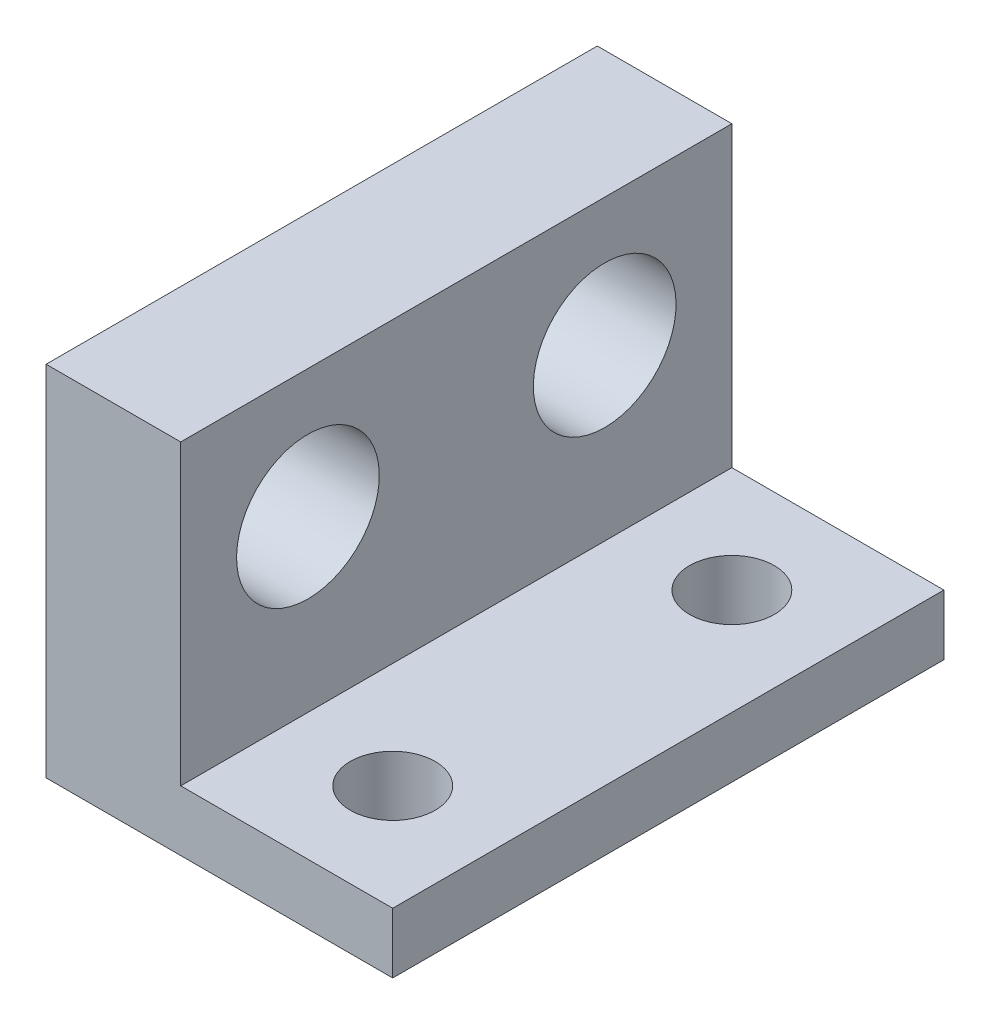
SolidWorks part; units mm, degrees
ref_plane "Front Plane" through (0, 0, 0) normal (0, 0, 1) x (1, 0, 0)
ref_plane "Top Plane" through (0, 0, 0) normal (0, 1, 0) x (1, 0, 0)
ref_plane "Right Plane" through (0, 0, 0) normal (1, 0, 0) x (0, 0, -1)
sketch "Sketch1" plane through (0, 0, 0) normal (0, 0, 1) x (1, 0, 0)
  line L0 (0, 25.4) -> (0, 0)
  line L1 (0, 0) -> (25.4, 0)
  line L2 (25.4, 0) -> (25.4, 6.35)
  line L3 (25.4, 6.35) -> (6.35, 6.35)
  line L4 (6.35, 6.35) -> (6.35, 25.4)
  line L5 (6.35, 25.4) -> (0, 25.4)
  dimension "D1" = 6.35
  dimension "D2" = 25.4
extrude "Boss-Extrude1" add sketch "Sketch1" along normal mid plane 26
sketch "Sketch2" plane through (0, 0, 0) normal (-1, 0, 0) x (0, 0, 1)
  line L0 (0, 0) -> (0, 25.4) construction
  line L1 (13, 25.4) -> (-13, 25.4) construction
  circle A0 centre (-7, 14.35) radius 3.3655
  circle A1 centre (7, 14.35) radius 3.3655
  dimension "D2" = 6.731
  dimension "D1" = 7
  dimension "D3" = 8
extrude "Cut-Extrude1" cut sketch "Sketch2" against normal up to next
sketch "Sketch4" plane through (0, 0, 0) normal (0, -1, 0) x (1, 0, 0)
  line L1 (0, 13) -> (25.4, 13)
  line L2 (0, 13) -> (0, -13)
  line L3 (0, -13) -> (25.4, -13)
  line L4 (25.4, 13) -> (25.4, -13)
extrude "Cut-Extrude3" cut sketch "Sketch4" against normal blind 3.5
sketch "Sketch5" plane through (0, 25.4, 0) normal (0, 1, 0) x (1, 0, 0)
  line L1 (0, 13) -> (6.35, 13)
  line L2 (0, 13) -> (0, -13)
  line L3 (0, -13) -> (6.35, -13)
  line L4 (6.35, 13) -> (6.35, -13)
extrude "Cut-Extrude4" cut sketch "Sketch5" against normal blind 5
sketch "Sketch6" plane through (0, 0, -13) normal (0, 0, -1) x (-1, 0, 0)
  line L6 (0, 20.4) -> (-6.35, 20.4)
  line L7 (-6.35, 20.4) -> (-6.35, 6.35)
  line L8 (-6.35, 6.35) -> (-25.4, 6.35)
  line L9 (-25.4, 6.35) -> (-25.4, 3.5)
  line L10 (-25.4, 3.5) -> (0, 3.5)
  line L11 (0, 3.5) -> (0, 20.4)
  line L12 (0, 20.4) -> (-6.35, 20.4)
  line L13 (-6.35, 20.4) -> (-6.35, 6.35)
  line L14 (-6.35, 6.35) -> (-25.4, 6.35)
  line L15 (-25.4, 6.35) -> (-25.4, 3.5)
  line L16 (-25.4, 3.5) -> (0, 3.5)
  line L17 (0, 3.5) -> (0, 20.4)
  dimension "D1" = 0
extrude "Boss-Extrude2" [suppressed] add sketch "Sketch6" along normal blind 29.5
sketch "Sketch7" plane through (0, 6.35, 0) normal (0, 1, 0) x (1, 0, 0)
  line L1 (16.35, 44.5) -> (25.4, 44.5)
  line L2 (16.35, 44.5) -> (16.35, -13)
  line L3 (16.35, -13) -> (25.4, -13)
  line L4 (25.4, 44.5) -> (25.4, -13)
  line L5 (6.35, -13) -> (6.35, 13) construction
  dimension "D1" = 10
extrude "Cut-Extrude5" cut sketch "Sketch7" against normal blind 30
sketch "Sketch3" plane through (0, 6.35, 0) normal (0, 1, 0) x (1, 0, 0)
  line L3 (6.35, -13) -> (6.35, 13) construction
  line L4 (16.35, -13) -> (6.35, -13) construction
  line L5 (16.35, 13) -> (6.35, 13) construction
  circle A0 centre (11.35, -8) radius 2
  circle A1 centre (11.35, 8) radius 2
  dimension "D3" = 4
  dimension "D1" = 5
  dimension "D2" = 5
  dimension "D4" = 5
extrude "Cut-Extrude2" cut sketch "Sketch3" against normal up to next
sketch "Sketch8" [suppressed] plane through (0, 0, 0) normal (-1, 0, 0) x (0, 0, 1)
  line L0 (-44.5, 3.5) -> (-44.5, 20.4) construction
  line L1 (-44.5, 14.35) -> (-14, 14.35)
  line L3 (14, 14.35) -> (14, 3.5)
  line L4 (15, 3.5) -> (-44.5, 3.5) construction
  line L5 (14, 3.5) -> (18, 3.5)
  line L6 (18, 3.5) -> (18, 25.4)
  line L7 (18, 25.4) -> (-44.5, 25.4)
  line L8 (-44.5, 25.4) -> (-44.5, 14.35)
  line L9 (15, 20.4) -> (15, 3.5) construction
  line L10 (-44.5, 20.4) -> (15, 20.4) construction
  arc A1 (-14, 14.35) -> (0, 14.35) centre (-7, 14.35) cw
  arc A2 (0, 14.35) -> (14, 14.35) centre (7, 14.35) cw
  dimension "D1" = 7
  dimension "D2" = 3
  dimension "D3" = 5
extrude "Cut-Extrude6" [suppressed] cut sketch "Sketch8" against normal up to next
sketch "Sketch9" [suppressed] plane through (0, 0, 0) normal (-1, 0, 0) x (0, 0, 1)
  line L0 (-14, 20.4) -> (-14, 6.35)
  line L1 (-44.5, 20.4) -> (15, 20.4) construction
  line L2 (-14, 6.35) -> (-34.5, 6.35)
  line L3 (-34.5, 6.35) -> (-34.5, 13.5)
  line L4 (-34.5, 13.5) -> (-44.5, 13.5)
  line L5 (-44.5, 3.5) -> (-44.5, 20.4) construction
  line L6 (-44.5, 13.5) -> (-44.5, 20.4)
  line L7 (-44.5, 20.4) -> (-14, 20.4)
  line L8 (15, 3.5) -> (-44.5, 3.5) construction
  line L9 (15, 6.35) -> (-44.5, 6.35) construction
  circle A0 centre (-7, 14.35) radius 3.175 construction
  dimension "D1" = 7
  dimension "D2" = 10
  dimension "D3" = 10
extrude "Cut-Extrude7" [suppressed] cut sketch "Sketch9" against normal up to next
